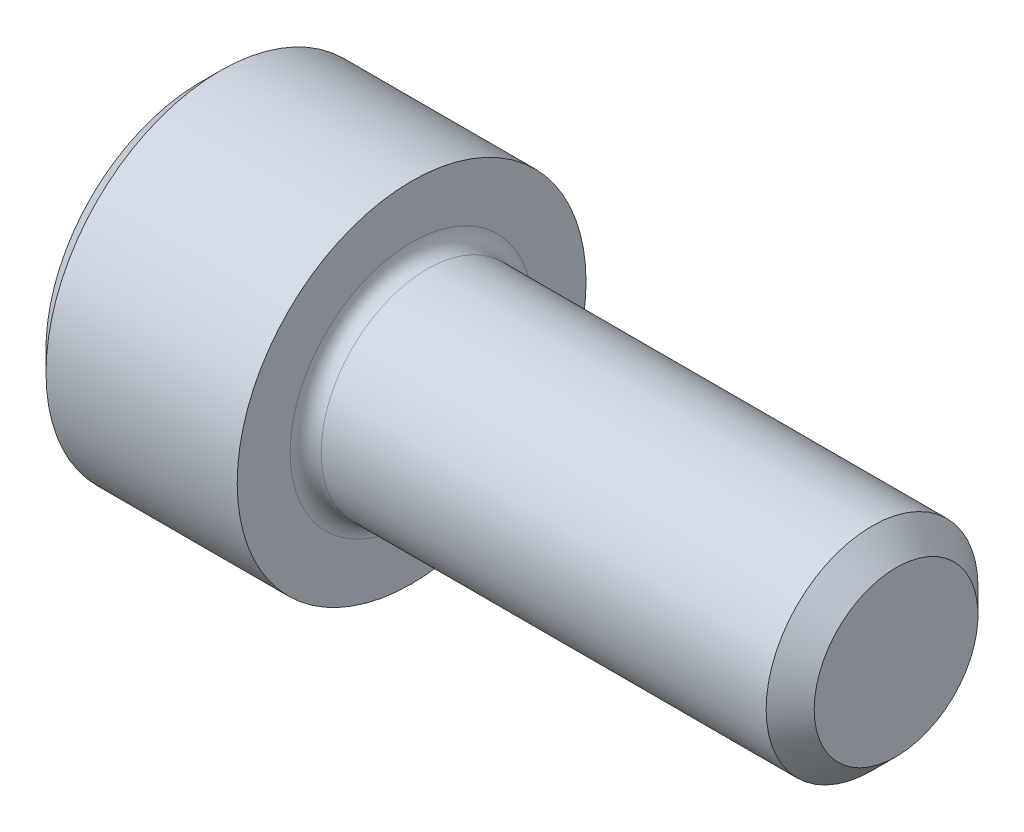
SolidWorks part; units mm, degrees
revolve "Base-Revolve" add sketch "BodySke"
sketch "BodySke" plane through (0, 0, 0) normal (0, 0, 1) x (1, 0, 0)
  line L0 (0, 0) -> (0, 3.0226)
  line L1 (0.4064, 3.429) -> (4.1656, 3.429)
  line L2 (4.1656, 3.429) -> (4.1656, 2.0828)
  line L3 (4.1656, 2.0828) -> (13.2182, 2.0828)
  line L4 (13.6906, 1.6104) -> (13.6906, 0)
  line L5 (13.6906, 0) -> (0, 0)
  line L6 (-31.75, 0) -> (127, 0) construction
  line L7 (0, 3.0226) -> (0.4064, 3.429)
  line L8 (13.6906, 1.6104) -> (13.2182, 2.0828)
  line L9 (0, -3.0226) -> (0.4064, -3.429) construction
  line L10 (13.6906, -1.6104) -> (13.2182, -2.0828) construction
  line L11 (4.9581, 9.525) -> (4.9581, 3.175) construction
  line L12 (4.1656, 9.525) -> (4.1656, 3.175) construction
  line L13 (-24.4094, 9.525) -> (-24.4094, 3.175) construction
  dimension "Diameter" = 4.1656
  dimension "Head_ht" = 4.1656
  dimension "Length" = 9.525
  dimension "Body_ch_ang" = 45
  dimension "Head_dia" = 6.858
  dimension "Head_ch_ang" = 45
  dimension "Head_side_ht" = 3.7592
  dimension "Minor_dia" = 3.2207
  dimension "Advance" = 0.7925
  dimension "Thread_nom" = 9.525
  dimension "Thread_length" = 38.1
fillet "Fillet1" radius 0.3048 1 edges at (4.1656, 0, 2.0828)
ref_plane "Plane1" through (0, 0, 0) normal (0, 0, 1) x (1, 0, 0)
ref_plane "Plane2" through (0, 0, 0) normal (0, 1, 0) x (1, 0, 0)
ref_plane "Plane3" through (0, 0, 0) normal (1, 0, 0) x (0, 0, -1)
sketch "Sketch2" plane through (0, 0, 0) normal (0, 0, 1) x (1, 0, 0)
  line L0 (0, 1.778) -> (1.9558, 1.778)
  line L1 (1.9558, 1.778) -> (2.9823, 0)
  line L2 (-31.75, 0) -> (127, 0) construction
  line L3 (2.9823, 0) -> (0, 0)
  line L4 (0, 0) -> (0, 1.778)
  line L5 (0, 3.0226) -> (0, -3.0226) construction
  line L6 (0, 0) -> (47.625, 0) construction
  line L7 (4.1656, -3.429) -> (4.1656, 3.429) construction
revolve "Hex-PreBroach" cut sketch "Sketch2" angle 360 about L6
sketch "Sketch3" plane through (0, 0, 0) normal (-1, 0, 0) x (0, 0.5, 0.866)
  line L0 (1.0265, 1.778) -> (-1.0265, 1.778)
  line L1 (-1.0265, 1.778) -> (-2.0531, 0)
  line L2 (1.0265, 1.778) -> (2.0531, 0)
  line L3 (1.0265, -1.778) -> (2.0531, 0)
  line L4 (1.0265, -1.778) -> (-1.0265, -1.778)
  line L5 (-1.0265, -1.778) -> (-2.0531, 0)
extrude "Hex" cut sketch "Sketch3" against normal blind 1.9558
sketch "Sketch4" plane through (0, 0, 0) normal (-1, 0, 0) x (0, 0, 1)
  line L0 (0, 0) -> (2.1971, 0)
  line L1 (0, 0) -> (6.1484, 3.5498) construction
  line L2 (0, 0) -> (1.0985, 1.9027)
  line L3 (1.8302, 0.5287) -> (2.0897, 0.6786)
  line L4 (1.373, 1.3206) -> (1.6325, 1.4704)
  arc A0 (1.8302, 0.5287) -> (1.373, 1.3206) centre (0, 0) ccw
  arc A1 (2.1971, 0) -> (2.0897, 0.6786) centre (0, 0) ccw
  arc A2 (1.0985, 1.9027) -> (1.6325, 1.4704) centre (0, 0) cw
extrude "Spline" [suppressed] cut sketch "Sketch4" against normal blind 1.9558
pattern_circular "CirPattern1" [suppressed] count 6 every 60
sketch "Sketch5" plane through (0, 0, 0) normal (0, 0, 1) x (1, 0, 0)
  line L0 (-31.75, 0) -> (127, 0) construction
  line L2 (0, 3.0226) -> (0, -3.0226) construction
  circle A0 centre (1.524, 0) radius 0.5905
  dimension "Drilled_hole_dia" = 1.1811
  dimension "Drilled_hole_loc" = 1.524
extrude "Hole" [suppressed] cut sketch "Sketch5" against normal through all and the other way through all
pattern_circular "Drilled-4" [suppressed] count 2 every 60
pattern_circular "Drilled-6" [suppressed] count 3 every 60
sketch "ThdSchSke" plane through (0, 0, 0) normal (0, 0, 1) x (1, 0, 0)
  line L0 (4.9581, -1.6104) -> (4.6273, -2.0828)
  line L1 (4.9581, -1.6104) -> (5.2889, -2.0828)
  line L2 (5.2889, -2.0828) -> (5.2889, -2.6035)
  line L3 (-3.175, 0) -> (5.1513, 0) construction
  line L5 (5.2889, -2.6035) -> (4.6273, -2.6035)
  line L6 (4.6273, -2.6035) -> (4.6273, -2.0828)
  line L7 (0, 3.0226) -> (0, -3.0226) construction
revolve "ThreadSchematic" [suppressed] cut sketch "ThdSchSke" angle 360 about L3
pattern_linear "ThdSchPat" [suppressed]
equation "\"D2@Sketch3\" = \"Hex_size@Sketch3\" / 2"
equation "\"D1@Sketch3\" = \"Hex_size@Sketch3\" / 2"
equation "\"D1@Sketch2\" = \"Hex_size@Sketch3\" / 2"
equation "\"D3@Sketch4\" = \"Spline_p_dim@Sketch4\" / 2"
equation "\"Thread_minor@ThreadCosmetic\"  =  \"Minor_dia@BodySke\""
equation "\"D2@CirPattern1\" = 360 / \"Num_teeth@CirPattern1\""
equation "\"Wall_thickness@Sketch2\" = \"Head_ht@BodySke\" - \"Key_eng@Hex\""
equation "\"Thread_length@ThreadCosmetic\" = ((sgn( (\"Length@BodySke\" - \"Advance@BodySke\" ) - \"Thread_nom@BodySke\" )-1)*( (\"Length@BodySke\" - \"Advance@BodySke\" ) - \"Thread_nom@BodySke\" ))/-2+ \"Thread_nom@BodySke\""
equation "\"Thread_minor@ThdSchSke\" = \"Minor_dia@BodySke\""
equation "\"Diameter@ThdSchSke\" = \"Diameter@BodySke\""
equation "\"Overcut@ThdSchSke\" = \"Diameter@BodySke\" * 1.25"
equation "\"Start@ThdSchSke\" = \"Head_ht@BodySke\" + \"Length@BodySke\" - \"Thread_length@ThreadCosmetic\"  '---Non-countersunk---"
equation "\"Num_threads@ThdSchPat\" = int( \"Thread_length@ThreadCosmetic\" / \"Advance@BodySke\" + 0.999 )  + 1"
equation "\"Advance@ThdSchPat\" = \"Thread_length@ThreadCosmetic\" /  (\"Num_threads@ThdSchPat\" - 1) 'relax it"
equation "\"Num_threads@ThdSchPat\" = \"Num_threads@ThdSchPat\" - sgn( \"Num_threads@ThdSchPat\" - 1) '---chamfered tips only---"
